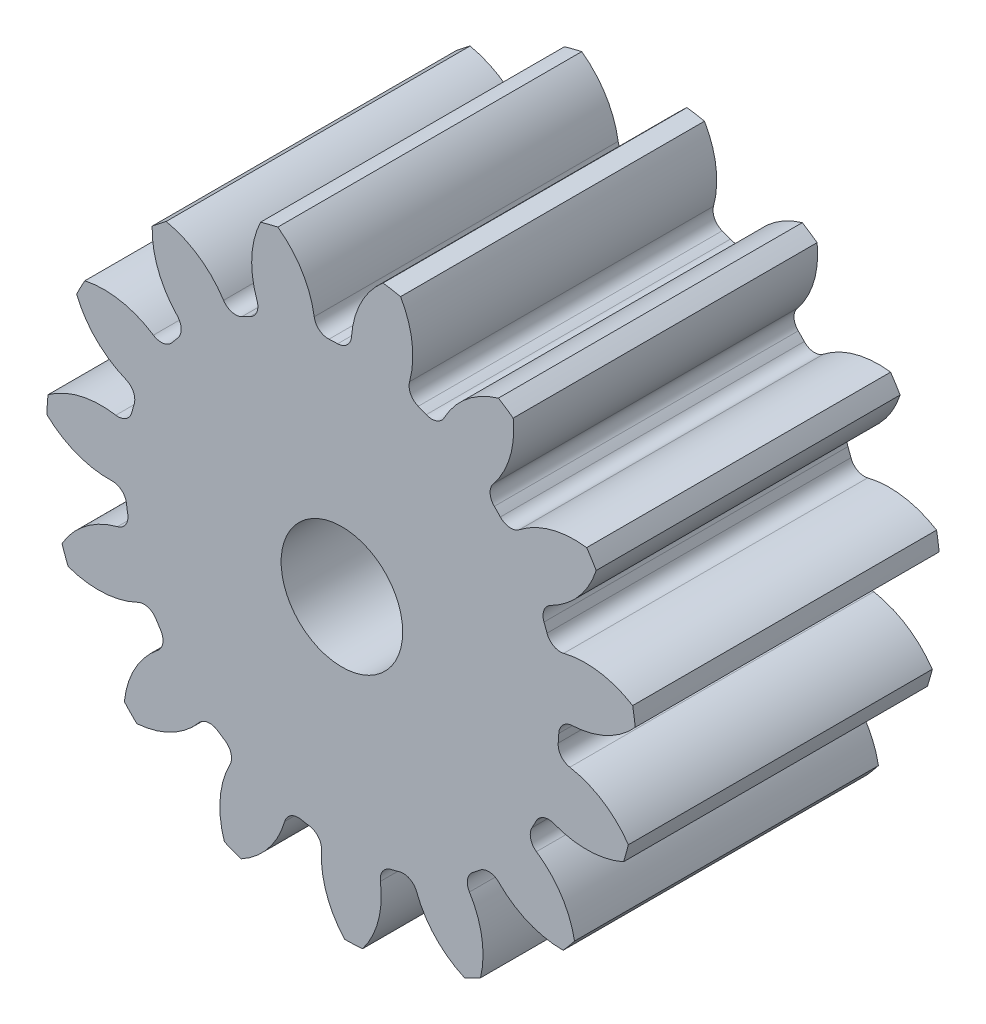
SolidWorks part; units mm, degrees
ref_plane "Front" through (0, 0, 0) normal (0, 0, 1) x (1, 0, 0)
ref_plane "Top" through (0, 0, 0) normal (0, 1, 0) x (1, 0, 0)
ref_plane "Right" through (0, 0, 0) normal (1, 0, 0) x (0, 0, -1)
sketch "Sketch3" plane through (0, 0, 0) normal (0, 0, 1) x (1, 0, 0)
  circle A0 centre (0, 0) radius 86.36
  dimension "od" = 172.72
extrude "gearBody" add sketch "Sketch3" along normal blind 88.9
sketch "Sketch2" plane through (0, 0, 0) normal (0, 0, 1) x (1, 0, 0)
  line L0 (0, 0) -> (66.154, 27.4019) construction
  line L1 (84.2648, -21.617) -> (0, 0) construction
  line L2 (0, 0) -> (36.3143, 0) construction
  line L3 (76.1405, 3.0102) -> (75.103, -12.8835) construction
  line L5 (75.6217, -4.9367) -> (0, 0) construction
  line L7 (0, 0) -> (71.6046, 0) construction
  arc A0 (71.5865, 1.611) -> (70.7695, -10.9041) centre (0, 0) ccw construction
  arc A1 (85.7987, 9.8301) -> (83.7926, -20.9011) centre (0, 0) ccw construction
  arc A2 (76.1405, 3.0102) -> (75.103, -12.8835) centre (0, 0) ccw construction
  arc A3 (63.2699, -5.401) -> (63.4351, -2.8705) centre (0, 0) ccw
  arc A4 (84.2648, -21.617) -> (66.6632, -9.8234) centre (62.0301, -35.7699) ccw
  arc A5 (84.2648, -21.617) -> (86.36, 10.4785) centre (0, 0) ccw
  arc A6 (86.36, 10.4785) -> (67.3745, 1.0733) centre (66.154, 27.4019) cw
  arc A7 (63.4351, -2.8705) -> (67.3745, 1.0733) centre (67.566, -3.0574) cw
  arc A8 (66.6632, -9.8234) -> (63.2699, -5.401) centre (67.39, -5.7527) cw
  point P6 (86.36, 10.4785)
  point P22 (84.2648, -21.617)
  dimension "baseDia" = 143.2092
  dimension "od" = 172.72
  dimension "pd" = 152.4
  dimension "rd" = 127
  dimension "rFillet" = 4.1351
  dimension "pointX" = 86.36
  dimension "pointY" = 10.4785
  dimension "CTT" = 15.8937
  dimension "flankCenterAngle" = 22.5
extrude "toothCut" cut sketch "Sketch2" along normal through all
pattern_circular "CirPattern1" count 15 over 360 about axis through (0, 0, 0) along (0, 0, 1) of "toothCut"
sketch "hub1Dia" plane through (0, 0, 0) normal (0, 0, -1) x (-1, 0, 0)
  circle A0 centre (0, 0) radius 12.7
  dimension "hub1Dia" = 25.4
sketch "hub2Dia" plane through (0, 0, 88.9) normal (0, 0, 1) x (1, 0, 0)
  circle A0 centre (0, 0) radius 12.7
  dimension "hub2dia" = 25.4
sketch "boreDia" plane through (0, 0, 0) normal (0, 0, 1) x (1, 0, 0)
  circle A0 centre (0, 0) radius 17.78
  dimension "boreDia" = 35.56
extrude "bore" cut sketch "boreDia" against normal mid plane 25400
